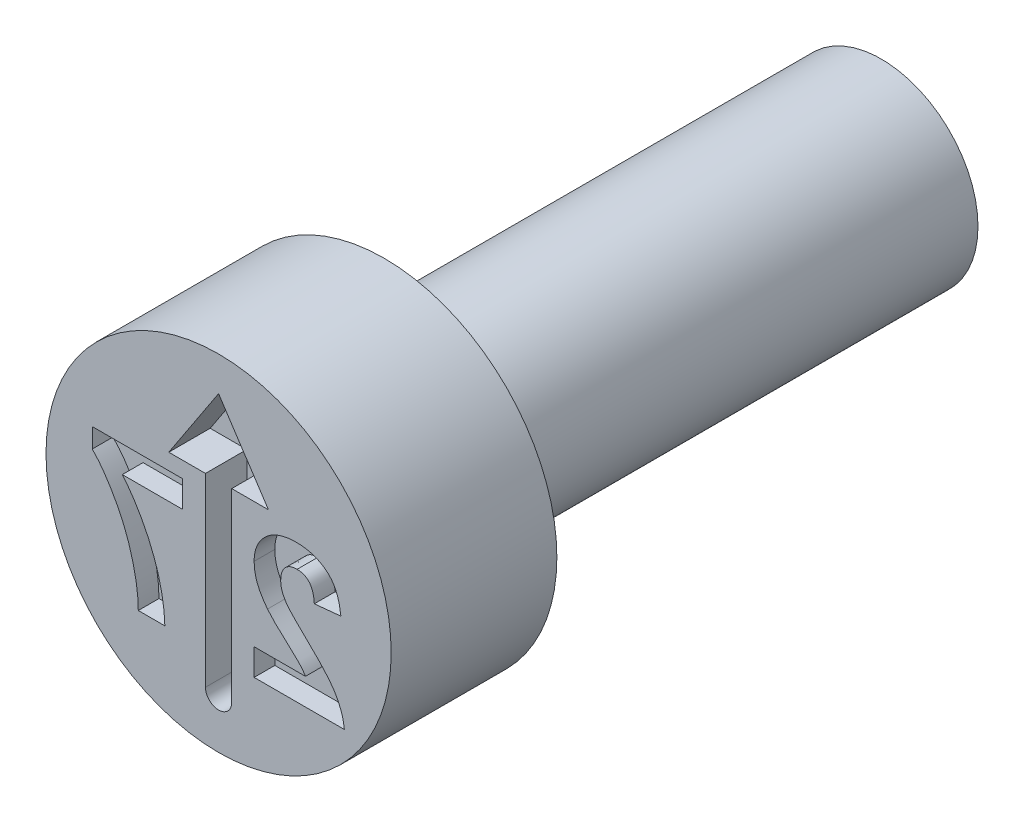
SolidWorks part; units mm, degrees
ref_plane "Front Plane" through (0, 0, 0) normal (0, 0, 1) x (1, 0, 0)
ref_plane "Top Plane" through (0, 0, 0) normal (0, 1, 0) x (1, 0, 0)
ref_plane "Right Plane" through (0, 0, 0) normal (1, 0, 0) x (0, 0, -1)
sketch "Sketch2" plane through (0, 0, 0) normal (1, 0, 0) x (0, 0, -1)
  line L0 (0.4039, 0) -> (50000.4039, 0) construction
  line L6 (0, 1.25) -> (0, 0)
  line L7 (1.2, 1.25) -> (0, 1.25)
  line L8 (1.2, 0.7) -> (1.2, 1.25)
  line L9 (4.8, 0.7) -> (1.2, 0.7)
  line L10 (4.8, 0) -> (4.8, 0.7)
  line L11 (0, 0) -> (4.8, 0)
  dimension "D1" = 2.5
  dimension "D2" = 1.4
  dimension "D3" = 4.8
  dimension "D4" = 1.2
revolve "Revolve1" add sketch "Sketch2" angle 360 about L0
sketch "Sketch3" plane through (0, 0, 0) normal (0, 0, 1) x (1, 0, 0)
  line L0 (0, 0) -> (0, 50000) construction
  line L1 (0.0952, 0.4532) -> (0.0952, -0.8881)
  line L2 (0.361, 0.4532) -> (0.0952, 0.4532)
  line L3 (0, 1.0011) -> (0.361, 0.4532)
  line L15 (0, 1.0011) -> (-0.361, 0.4532)
  line L16 (-0.361, 0.4532) -> (-0.0952, 0.4532)
  line L17 (-0.0952, 0.4532) -> (-0.0952, -0.8881)
  arc A2 (-0.0952, -0.8881) -> (0.0952, -0.8881) centre (0, -0.8881) ccw
extrude "Cut-Extrude4" cut sketch "Sketch3" against normal blind 0.3
sketch "Sketch4" plane through (0, 0, 0) normal (0, 0, 1) x (1, 0, 0)
  text T0 "2 7" font "Arial" height 1
  dimension "D1" = 0.65
extrude "Cut-Extrude5" cut sketch "Sketch4" against normal blind 0.15
